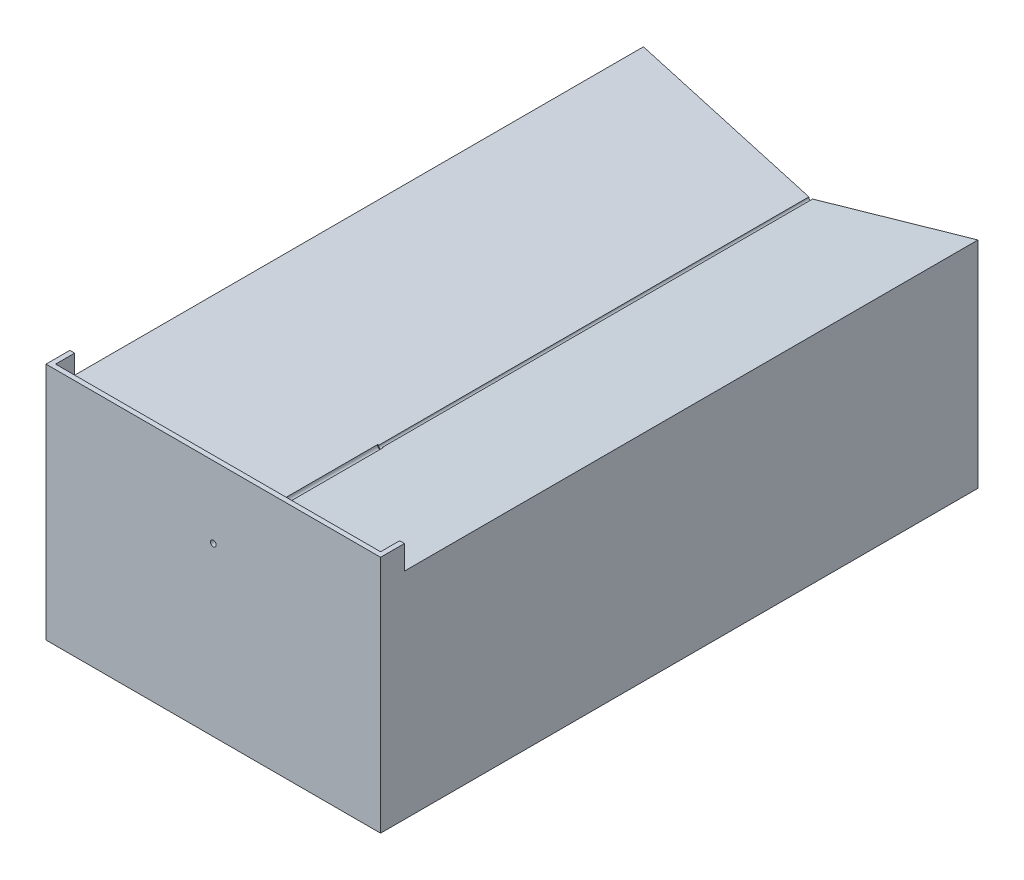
SolidWorks part; units mm, degrees
ref_plane "Plano frontal" through (0, 0, 0) normal (0, 0, 1) x (1, 0, 0)
ref_plane "Plano superior" through (0, 0, 0) normal (0, 1, 0) x (1, 0, 0)
ref_plane "Plano direito" through (0, 0, 0) normal (1, 0, 0) x (0, 0, -1)
sketch "Esboço1" plane through (0, 0, 0) normal (0, 0, 1) x (1, 0, 0)
  line L1 (35, -22.5) -> (-35, -22.5)
  line L2 (35, -22.5) -> (35, 22.5)
  line L4 (-35, -22.5) -> (-35, 22.5)
  line L5 (35, -22.5) -> (-35, 22.5) construction
  line L6 (35, 22.5) -> (-35, -22.5) construction
  line L7 (-35, 22.5) -> (-0.3846, 12.6099)
  line L8 (0.3846, 12.6099) -> (35, 22.5)
  arc A0 (-0.3846, 12.6099) -> (0.3846, 12.6099) centre (0, 12.5) ccw
  point P0 (0, 0)
  dimension "D3" = 0.8
  dimension "D1" = 45
  dimension "D2" = 70
extrude "Ressalto-extrusão2" add sketch "Esboço1" along normal blind 120
sketch "Esboço2" plane through (0, 0, 120) normal (0, 0, 1) x (1, 0, 0)
  line L0 (-35, -22.5) -> (35, -22.5)
  line L1 (-35, -22.5) -> (-35, 27.5)
  line L2 (35, -22.5) -> (35, 27.5)
  line L3 (-35, 27.5) -> (35, 27.5)
  dimension "D1" = 50
extrude "Ressalto-extrusão3" add sketch "Esboço2" along normal blind 5
sketch "Esboço3" plane through (0, 27.5, 0) normal (0, 1, 0) x (1, 0, 0)
  line L5 (35, -124) -> (-35, -124)
  line L6 (34, -124) -> (-34, -124)
  line L8 (-34, -125) -> (-34, -120)
  line L9 (-34, -124) -> (-34, -120)
  line L10 (-34, -120) -> (34, -120)
  line L11 (34, -125) -> (34, -120)
  line L12 (34, -124) -> (34, -120)
  dimension "D1" = 1
  dimension "D2" = 1
  dimension "D3" = 1
extrude "Corte-extrusão1" cut sketch "Esboço3" against normal blind 48
sketch "Esboço5" plane through (0, 0, 0) normal (0, 0, -1) x (-1, 0, 0)
  circle A0 centre (0, 12.5) radius 0.4
extrude "Corte-extrusão4" cut sketch "Esboço5" against normal blind 127
sketch "Esboço6" plane through (0, 0, 125) normal (0, 0, 1) x (1, 0, 0)
  circle A0 centre (0, 12.5) radius 0.6
  dimension "D1" = 1.2
extrude "Corte-extrusão6" cut sketch "Esboço6" against normal blind 35
